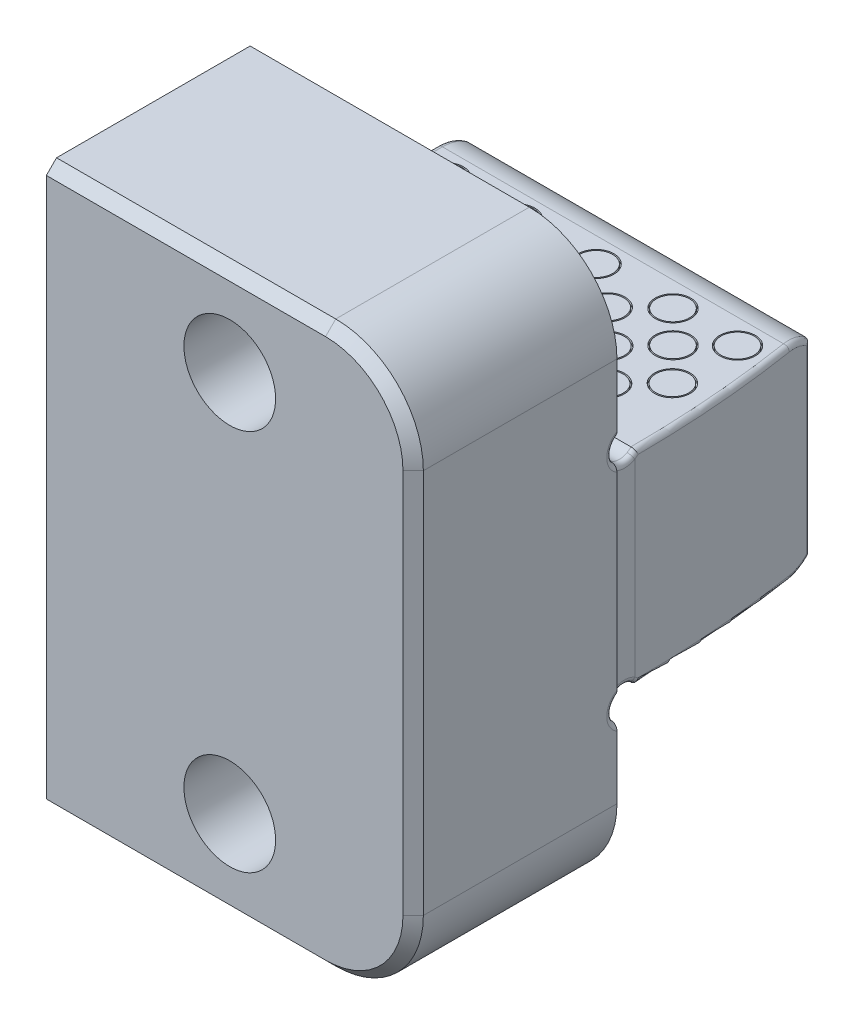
SolidWorks part; units mm, degrees
ref_plane "Front Plane" through (0, 0, 0) normal (0, 0, 1) x (1, 0, 0)
ref_plane "Top Plane" through (0, 0, 0) normal (0, 1, 0) x (1, 0, 0)
ref_plane "Right Plane" through (0, 0, 0) normal (1, 0, 0) x (0, 0, -1)
sketch "Sketch3" plane through (0, 0, 0) normal (1, 0, 0) x (0, 0, -1)
  line L0 (0, 19.8266) -> (0, -19.8266) construction
  line L1 (-20, -27.5) -> (0, -27.5)
  line L2 (-20, -27.5) -> (-20, 27.5)
  line L3 (-20, 27.5) -> (0, 27.5)
  line L4 (20.87, -9.9975) -> (20.87, 9.9975)
  line L6 (0, -27.5) -> (0, -9.9975)
  line L7 (0, -9.9975) -> (20.87, -9.9975)
  line L8 (0, 27.5) -> (0, 9.9975)
  line L9 (0, 9.9975) -> (20.87, 9.9975)
  line L10 (0, 0) -> (50000, 0) construction
  dimension "D1" = 40.87
  dimension "D2" = 20
  dimension "D3" = 55
  dimension "D4" = 19.995
extrude "Extrude1" add sketch "Sketch3" along normal mid plane 36
sketch "Sketch7" plane through (18, 0, 0) normal (1, 0, 0) x (0, 0, -1)
  line L0 (0, 27.5) -> (-20, 27.5) construction
  line L1 (0, -27.5) -> (21.9683, -27.5)
  line L2 (0, -27.5) -> (0, 27.5)
  line L3 (0, 27.5) -> (21.9683, 27.5)
  line L4 (21.9683, -27.5) -> (21.9683, 27.5)
  line L5 (0, -27.5) -> (0, -9.9975) construction
  line L6 (-20, -27.5) -> (0, -27.5) construction
extrude "Cut-Extrude3" cut sketch "Sketch7" against normal blind 0.25
sketch "Sketch8" plane through (18, 0, 0) normal (1, 0, 0) x (0, 0, -1)
  line L0 (0, 0) -> (50000, 0) construction
  line L1 (0, -27.5) -> (0, 27.5) construction
  line L2 (0, 9.9975) -> (20.87, 9.9975) construction
  circle A0 centre (1, 10.9975) radius 1.5
  circle A1 centre (1, -10.9975) radius 1.5
  dimension "D1" = 1.5
  dimension "D2" = 0.5
  dimension "D3" = 0.5
extrude "Cut-Extrude4" cut sketch "Sketch8" against normal through all
sketch "Sketch9" plane through (18, 0, 0) normal (1, 0, 0) x (0, 0, -1)
  line L0 (2.118, 9.9975) -> (20.87, 9.9975) construction
  line L1 (20.87, 9.9975) -> (20.87, -9.9975) construction
  line L2 (0, 0) -> (50000, 0) construction
  line L3 (20.87, 9.1385) -> (24.87, 9.1385)
  line L4 (18.37, 9.9975) -> (18.37, 15.6385)
  line L5 (18.37, 15.6385) -> (24.87, 15.6385)
  line L6 (24.87, 9.1385) -> (24.87, 15.6385)
  line L7 (24.87, -9.1385) -> (24.87, -15.6385)
  line L8 (18.37, -15.6385) -> (24.87, -15.6385)
  line L9 (18.37, -9.9975) -> (18.37, -15.6385)
  line L10 (20.87, -9.1385) -> (24.87, -9.1385)
  arc A0 (18.37, 9.9975) -> (20.5439, 9.6072) centre (18.37, 3.7475) cw construction
  arc A1 (20.5439, 9.6072) -> (20.87, 9.1385) centre (20.37, 9.1385) cw construction
  arc A2 (20.5439, -9.6072) -> (20.87, -9.1385) centre (20.37, -9.1385) ccw construction
  arc A3 (18.37, -9.9975) -> (20.5439, -9.6072) centre (18.37, -3.7475) ccw construction
  arc A4 (18.37, 9.9975) -> (20.87, 9.1385) centre (18.37, 5.9302) cw
  arc A5 (18.37, -9.9975) -> (20.87, -9.1385) centre (18.37, -5.9302) ccw
  dimension "D1" = 0.5
  dimension "D2" = 6.25
  dimension "D3" = 2.5
  dimension "D4" = 6.5
  dimension "D5" = 6.5
extrude "Cut-Extrude5" cut sketch "Sketch9" against normal through all
sketch "Sketch13" plane through (0, 27.5, 0) normal (0, 1, 0) x (1, 0, 0)
  line L0 (17.75, 2.118) -> (17.75, 18.37) construction
  line L2 (14.7597, 27) -> (34.7597, 27)
  line L4 (17.75, 2) -> (34.7597, 2)
  line L5 (34.7597, 27) -> (34.7597, 2)
  arc A0 (14.7597, 27) -> (17.75, 2) centre (-88.25, 2) cw
  dimension "D1" = 106
  dimension "D2" = 2
  dimension "D3" = 25
  dimension "D4" = 20
extrude "Cut-Extrude6" cut sketch "Sketch13" against normal through all
sketch "Sketch15" plane through (0, 9.9975, 0) normal (0, 1, 0) x (1, 0, 0)
  circle A0 centre (13.8798, 15.9538) radius 1.75
  circle A1 centre (13.8798, 15.9538) radius 1.62
  circle A2 centre (0, 15.9538) radius 1.75
  circle A3 centre (0, 15.9538) radius 1.62
  circle A4 centre (-14.7747, 15.9538) radius 1.75
  circle A5 centre (-14.7747, 15.9538) radius 1.62
  circle A6 centre (-7.7418, 15.9538) radius 1.75
  circle A7 centre (-7.7418, 15.9538) radius 1.62
  circle A8 centre (7.5445, 15.9538) radius 1.75
  circle A9 centre (7.5445, 15.9538) radius 1.62
  circle A12 centre (4.2315, 12.8151) radius 1.75
  circle A13 centre (4.2315, 12.8151) radius 1.62
  circle A14 centre (-11.636, 12.8151) radius 1.75
  circle A15 centre (-11.636, 12.8151) radius 1.62
  circle A16 centre (-3.6151, 12.8151) radius 1.75
  circle A17 centre (-3.6151, 12.8151) radius 1.62
  circle A18 centre (10.6831, 12.8151) radius 1.75
  circle A19 centre (10.6831, 12.8151) radius 1.62
  circle A20 centre (13.8798, 9.5603) radius 1.75
  circle A21 centre (13.8798, 9.5603) radius 1.62
  circle A22 centre (0, 9.5603) radius 1.75
  circle A23 centre (0, 9.5603) radius 1.62
  circle A24 centre (-14.7747, 9.5603) radius 1.75
  circle A25 centre (-14.7747, 9.5603) radius 1.62
  circle A26 centre (-7.7418, 9.5603) radius 1.75
  circle A27 centre (-7.7418, 9.5603) radius 1.62
  circle A28 centre (7.5445, 9.5603) radius 1.75
  circle A29 centre (7.5445, 9.5603) radius 1.62
  circle A32 centre (4.2315, 6.3054) radius 1.75
  circle A33 centre (4.2315, 6.3054) radius 1.62
  circle A34 centre (-11.171, 6.3054) radius 1.75
  circle A35 centre (-11.171, 6.3054) radius 1.62
  circle A36 centre (-3.6151, 6.3054) radius 1.75
  circle A37 centre (-3.6151, 6.3054) radius 1.62
  circle A38 centre (10.6831, 6.3054) radius 1.75
  circle A39 centre (10.6831, 6.3054) radius 1.62
  dimension "D3" = 3.5
  dimension "D4" = 3.24
extrude "Cut-Extrude7" cut sketch "Sketch15" against normal blind 0.254
mirror "Mirror1" about plane through (0, 0, 0) normal (0, 1, 0) of "Cut-Extrude7"
hole_wizard "CBORE for M8 SHCS1" positions "Sketch17" profile "Sketch16" counterbore size "M8" standard "Ansi Metric"
sketch "Sketch17" plane through (0, 0, 0) normal (0, 0, -1) x (-1, 0, 0)
  line L0 (0, 0) -> (50000, 0) construction
  point P0 (0, 18.75)
  point P9 (0, -18.75)
  dimension "D1" = 37.5
sketch "Sketch16" plane through (0, 18.75, 0) normal (1, 0, 0) x (0, 1, 0)
  line L0 (0, 0) -> (0, 20)
  line L1 (0, 20) -> (4.5, 20)
  line L3 (4.5, 20) -> (4.5, 10)
  line L4 (4.5, 10) -> (7.5, 10)
  line L5 (7.5, 10) -> (7.5, 0)
  line L7 (7.5, 0) -> (0, 0)
  line L11 (0, -6.35) -> (0, 107.95) construction
  dimension "Thru Hole Dia." = 9
  dimension "Thru Hole Depth" = 20
  dimension "C'Bore Dia." = 15
  dimension "C'Bore Depth" = 10
fillet "Fillet1" radius 8.6 2 edges at (18, -27.5, 10) (18, 27.5, 10)
chamfer "Chamfer1" distance 1 angle 45 5 edges at (-4.3, 27.5, 20) (-4.3, -27.5, 20) (18, 0, 20) (15.4811, 24.9811, 20) (15.4811, -24.9811, 20)
chamfer "Chamfer2" distance 0.4 angle 45 6 edges at (10.7488, -12.1155, 0) (0.8106, -11.2939, 0.4704) (0, -26.25, 0) (-10.7488, 12.1155, 0) (-0.8106, 11.2939, 0.4704) (0, 26.25, 0)
fillet "Fillet2" radius 0.5 18 edges at (-18, 9.9975, -10.244) (-18, -9.7768, -19.6917) (17.427, 9.9975, -10.2685) (16.2699, -9.7901, -19.6522) (-18, 9.7768, -19.6917) (-18, 0, -20.87) (-18, -9.9975, -10.244) (16.2564, 9.7627, -19.7318) (16.0569, 0, -20.87) (17.427, -9.9975, -10.2685) (18, -10.9975, 0.5) (17.875, -9.8795, 0) (17.75, -9.4975, -1) (17.875, 9.8795, 0) (18, 10.9975, 0.5) (17.75, 9.4975, -1)
